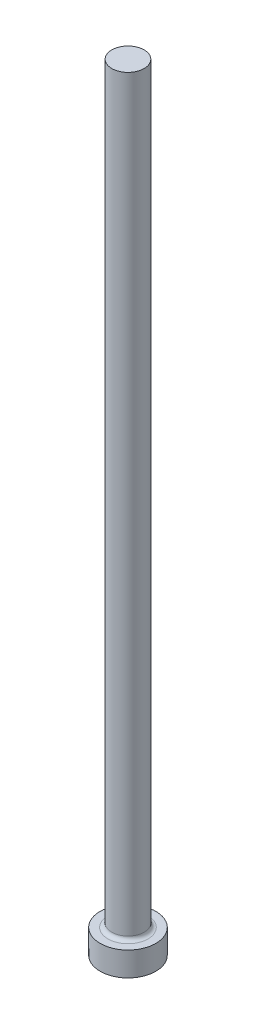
SolidWorks part; units mm, degrees
ref_plane "Front Plane" through (0, 0, 0) normal (0, 0, 1) x (1, 0, 0)
ref_plane "Top Plane" through (0, 0, 0) normal (0, 1, 0) x (1, 0, 0)
ref_plane "Right Plane" through (0, 0, 0) normal (1, 0, 0) x (0, 0, -1)
sketch "Sketch1" plane through (0, 0, 0) normal (0, 0, 1) x (1, 0, 0)
  line L0 (0, 0) -> (5.461, 0)
  line L1 (55, 0) -> (-55, 0) construction
  line L2 (5.461, 0) -> (5.461, 4.7498)
  line L3 (5.461, 4.7498) -> (3.937, 4.7498)
  line L4 (3.175, 5.5118) -> (3.175, 152.4)
  line L5 (3.175, 152.4) -> (0, 152.4)
  line L6 (0, 152.4) -> (0, 0)
  arc A0 (3.937, 4.7498) -> (3.175, 5.5118) centre (3.937, 5.5118) cw
  dimension "D5" = 0.762
  dimension "D1" = 3.175
  dimension "D2" = 5.461
  dimension "D3" = 4.7498
  dimension "D4" = 152.4
revolve "Revolve1" add sketch "Sketch1" angle 360 about L6
